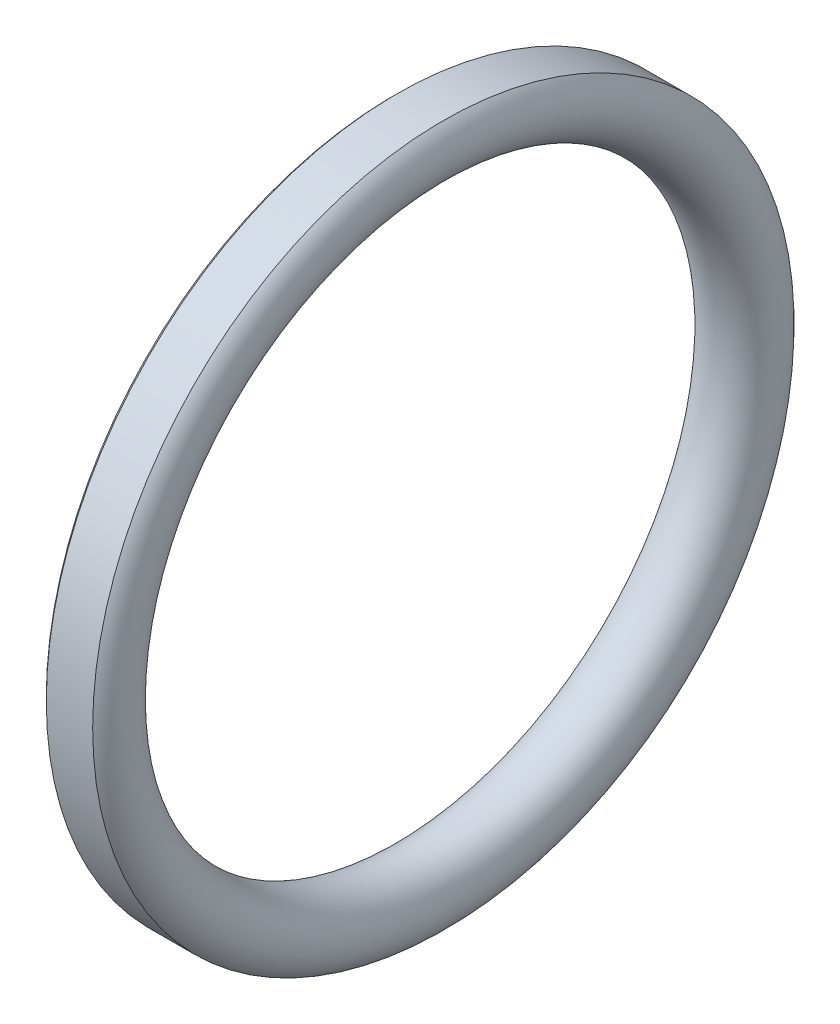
SolidWorks part; units mm, degrees
ref_plane "Plan1" through (0, 0, 0) normal (0, 0, 1) x (1, 0, 0)
ref_plane "Plan2" through (0, 0, 0) normal (0, 1, 0) x (1, 0, 0)
ref_plane "Plan3" through (0, 0, 0) normal (1, 0, 0) x (0, 0, -1)
sketch "Esquisse1" plane through (0, 0, 0) normal (0, 0, 1) x (1, 0, 0)
  line L0 (-18, 0) -> (25, 0) construction
  line L1 (-0.6614, 10) -> (0.6614, 10)
  arc A0 (-0.6614, 10) -> (0.6614, 10) centre (0, 9.25) ccw
  dimension "D1" = 2
  dimension "D2" = 9.25
  dimension "D3" = 10
revolve "Base-Révolution" add sketch "Esquisse1" angle 360 about L0
